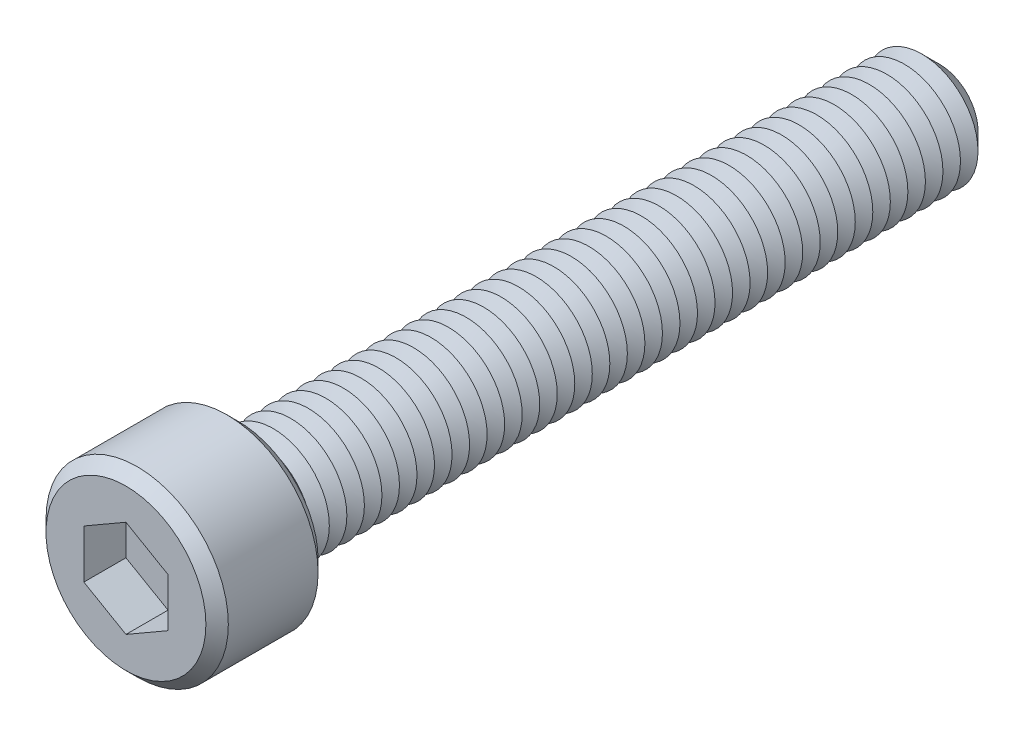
SolidWorks part; units mm, degrees
ref_plane "Front Plane" through (0, 0, 0) normal (0, 0, 1) x (1, 0, 0)
ref_plane "Top Plane" through (0, 0, 0) normal (0, 1, 0) x (1, 0, 0)
ref_plane "Right Plane" through (0, 0, 0) normal (1, 0, 0) x (0, 0, -1)
sketch "Sketch1" plane through (0, 0, 0) normal (0, 0, 1) x (1, 0, 0)
  circle A0 centre (0, 0) radius 6.5
  dimension "D1" = 13
extrude "Boss-Extrude1" add sketch "Sketch1" along normal blind 8
sketch "Sketch2" plane through (0, 0, 0) normal (0, 0, -1) x (-1, 0, 0)
  circle A0 centre (0, 0) radius 4
  dimension "D1" = 8
extrude "Boss-Extrude2" add sketch "Sketch2" along normal blind 50
chamfer "Chamfer1" distance 1.25 angle 45 1 edges at (-4, 0, -50)
sketch "Sketch3" plane through (0, 0, 0) normal (1, 0, 0) x (0, 0, -1)
  line L0 (-2.5121, 0) -> (4.5776, 0) construction
sketch "Sketch4" plane through (0, 0, 0) normal (1, 0, 0) x (0, 0, -1)
  line L0 (0, 4) -> (0.625, 2.9175)
  line L1 (0.625, 2.9175) -> (1.25, 4)
  line L2 (48.75, 4) -> (0, 4) construction
  line L3 (1.25, 4) -> (0, 4)
  dimension "D1" = 1.25
revolve "Cut-Revolve1" cut sketch "Sketch4" angle 360 about L0
pattern_linear "LPattern1" count 39 spacing 1.25 along (0, 0, -1) of "Cut-Revolve1"
sketch "Sketch5" plane through (0, 0, 8) normal (0, 0, 1) x (1, 0, 0)
  line L1 (0, 3.4641) -> (-3, 1.7321)
  line L2 (-3, 1.7321) -> (-3, -1.7321)
  line L3 (-3, -1.7321) -> (0, -3.4641)
  line L4 (0, -3.4641) -> (3, -1.7321)
  line L5 (3, -1.7321) -> (3, 1.7321)
  line L6 (3, 1.7321) -> (0, 3.4641)
  circle A0 centre (0, 0) radius 3 construction
  dimension "D1" = 6
extrude "Cut-Extrude1" cut sketch "Sketch5" against normal blind 3
sketch "Sketch6" plane through (0, 0, 5) normal (0, 0, 1) x (1, 0, 0)
  circle A0 centre (0, 0) radius 0.9
  dimension "D1" = 1.8
extrude "Cut-Extrude2" cut sketch "Sketch6" against normal up to surface (55 mm away)
chamfer "Chamfer2" distance 0.8 angle 45 2 edges at (6.5, 0, 0) (6.5, 0, 8)
